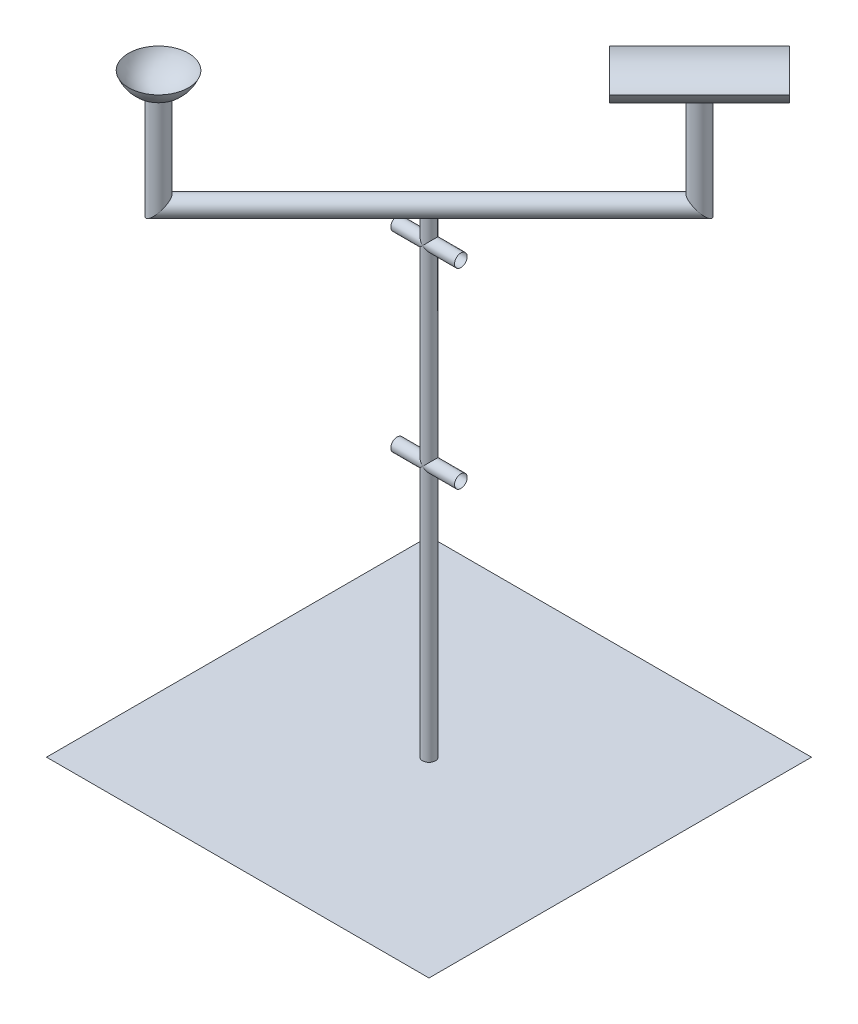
SolidWorks part; units mm, degrees
ref_plane "Plan de face" through (0, 0, 0) normal (0, 0, 1) x (1, 0, 0)
ref_plane "Plan de dessus" through (0, 0, 0) normal (0, 1, 0) x (1, 0, 0)
ref_plane "Plan de droite" through (0, 0, 0) normal (1, 0, 0) x (0, 0, -1)
sketch "Esquisse1" plane through (0, 0, 0) normal (0, 0, 1) x (1, 0, 0)
  line L3 (0, 50) -> (0, 200)
  line L4 (0, 0) -> (-134.1587, 0) construction
  dimension "D1" = 200
  dimension "D4" = 150
ref_plane "Plan2" through (0, 200, 0) normal (0, 1, 0) x (-1, 0, 0)
sketch "Esquisse3" plane through (0, 200, 0) normal (0, 1, 0) x (-1, 0, 0)
  circle A0 centre (0, 0) radius 2
  dimension "D1" = 4
surface "Surface-Balayage1"
sketch "Esquisse4" plane through (0, 0, 0) normal (0, 0, 1) x (1, 0, 0)
  point P0 (0, 0)
sketch "Esquisse15" plane through (0, 0, 0) normal (1, 0, 0) x (0, 0, -1)
  line L0 (-2, 200) -> (2, 200) construction
  point P0 (0, 200)
ref_plane "Plan3" through (0, 200, 0) normal (0, 1, 0) x (-1, 0, 0)
sketch "Esquisse5" plane through (0, 200, 0) normal (0, 1, 0) x (-1, 0, 0)
  line L0 (-85.5285, -85.5285) -> (85.5285, 85.5285) construction
  line L1 (0, 0) -> (59.5113, 0) construction
  dimension "D1" = 45
ref_plane "Plan4" through (0, 0, 0) normal (-0.7071, 0, -0.7071) x (-0.7071, 0, 0.7071)
sketch "Esquisse6" plane through (0, 0, 0) normal (-0.7071, 0, -0.7071) x (-0.7071, 0, 0.7071)
  line L0 (60, 230) -> (60, 200)
  line L1 (60, 200) -> (-60, 200)
  line L2 (-60, 200) -> (-60, 230)
  dimension "D1" = 120
  dimension "D2" = 30
  dimension "D3" = 30
ref_plane "Plan5" through (0, 230, 0) normal (0, 1, 0) x (-1, 0, 0)
sketch "Esquisse7" plane through (0, 230, 0) normal (0, 1, 0) x (-1, 0, 0)
  circle A0 centre (-42.4264, -42.4264) radius 3
  dimension "D1" = 6
surface "Surface-Balayage2"
sketch "Esquisse8" plane through (0, 0, 0) normal (-0.7071, 0, -0.7071) x (-0.7071, 0, 0.7071)
  line L0 (-40, 230) -> (-80, 230)
  line L1 (-33.0523, 240) -> (-86.4426, 240) construction
  point P4 (-60, 230)
  dimension "D1" = 240
  dimension "D2" = 20
  dimension "D3" = 40
  dimension "D4" = 60
surface "Surface-Révolution1" sketch "Esquisse8" parameters "D1"=140
sketch "Esquisse9" plane through (0, 0, 0) normal (-0.7071, 0, -0.7071) x (-0.7071, 0, 0.7071)
  line L0 (60, 216.4131) -> (60, 263.5869) construction
  line L2 (60, 240) -> (69.3969, 236.5798) construction
  arc A0 (60, 230) -> (69.3969, 236.5798) centre (60, 240) ccw
  dimension "D1" = 20
  dimension "D2" = 60
  dimension "D3" = 240
  dimension "D4" = 70
surface "Surface-Révolution2" sketch "Esquisse9" parameters "D1"=360
sketch "Esquisse10" plane through (0, 0, 0) normal (-0.7071, 0, -0.7071) x (-0.7071, 0, 0.7071)
  line L0 (60, 240) -> (-80, 240) construction
  dimension "D1" = 60
  dimension "D2" = 240
  dimension "D3" = 140
ref_plane "Plan6" through (0, 150, 0) normal (0, 1, 0) x (-1, 0, 0)
sketch "Esquisse11" plane through (0, 0, 0) normal (1, 0, 0) x (0, 0, -1)
  line L0 (0, 0) -> (0, 160) construction
  circle A0 centre (0, 160) radius 2
  dimension "D2" = 4
  dimension "D1" = 160
sketch "Esquisse16" plane through (0, 0, 0) normal (0, 0, 1) x (1, 0, 0)
  line L0 (-2, 50) -> (2, 50) construction
  point P0 (0, 50)
ref_plane "Plan7" through (0, 50, 0) normal (0, 1, 0) x (-1, 0, 0)
sketch "Esquisse13" plane through (0, 50, 0) normal (0, 1, 0) x (-1, 0, 0)
  line L0 (60, 60) -> (-60, -60) construction
  line L1 (60, 60) -> (-60, 60)
  line L2 (60, 60) -> (60, -60)
  line L3 (60, -60) -> (-60, -60)
  line L4 (-60, 60) -> (-60, -60)
  dimension "D1" = 45
  dimension "D2" = 120
surface "Surface-Plan1" sketch "Esquisse13"
sketch "Esquisse17" plane through (0, 0, 0) normal (1, 0, 0) x (0, 0, -1)
  circle A0 centre (0, 130) radius 2
  circle A1 centre (0, 190) radius 2
  dimension "D1" = 4
  dimension "D2" = 4
  dimension "D3" = 30
  dimension "D4" = 30
surface "Surface-Extrusion1" sketch "Esquisse17" parameters "D1"=20
ref_plane "Plan8" through (0, 160, 0) normal (0, 1, 0) x (-1, 0, 0)
